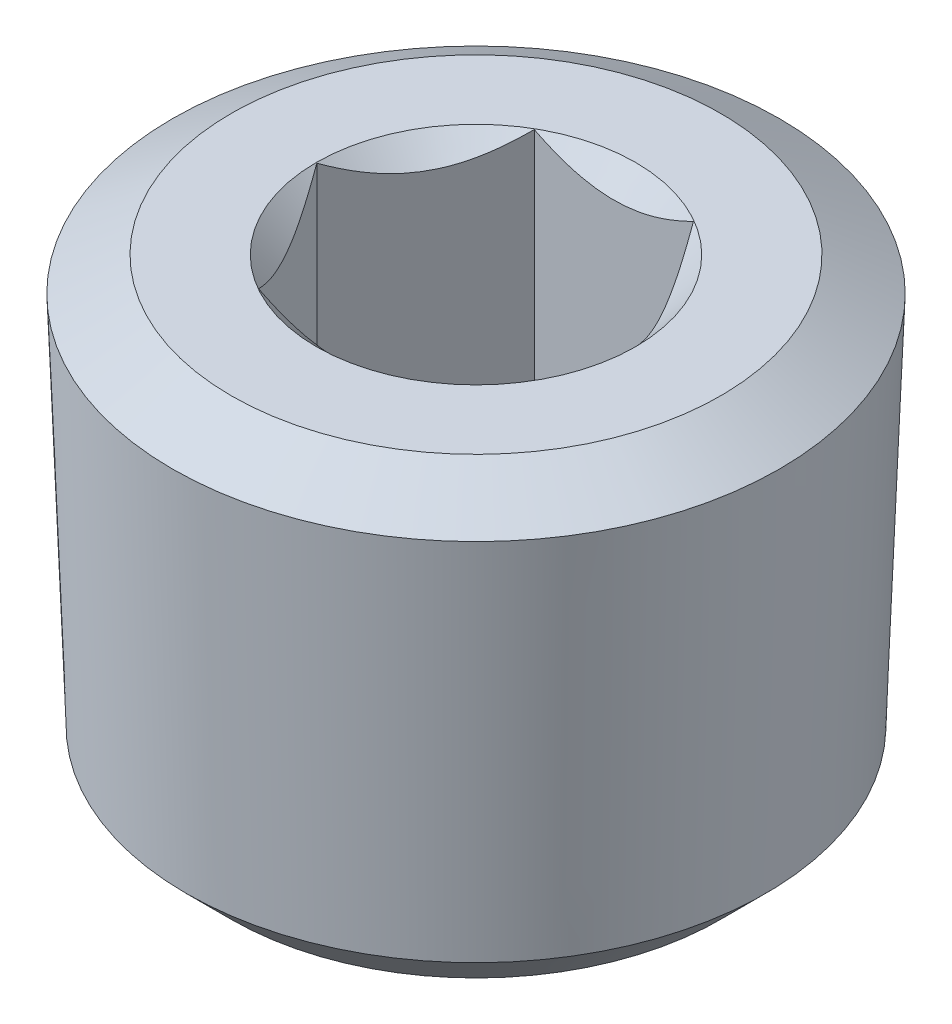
SolidWorks part; units mm, degrees
ref_plane "Front Plane" through (0, 0, 0) normal (0, 0, 1) x (1, 0, 0)
ref_plane "Top Plane" through (0, 0, 0) normal (0, 1, 0) x (1, 0, 0)
ref_plane "Right Plane" through (0, 0, 0) normal (1, 0, 0) x (0, 0, -1)
sketch "Sketch2" plane through (0, 0, 0) normal (0, 0, 1) x (1, 0, 0)
  line L0 (0, 10.7443) -> (0, -17.0657) construction
  line L1 (0, 0) -> (-8.5652, 0)
  line L2 (-10.6247, -1.189) -> (-10.1469, -14.2933)
  line L3 (-8.5652, -15.875) -> (0, -15.875)
  line L4 (0, -15.875) -> (0, 0)
  line L6 (-8.5652, -15.875) -> (-10.1469, -14.2933)
  line L7 (-8.5652, 0) -> (-10.6247, -1.189)
  point P4 (-10.668, 0)
  point P6 (-10.0892, -15.875)
  dimension "D1" = 15.875
  dimension "D2" = 2.088
  dimension "D3" = 21.336
  dimension "D4" = 30
  dimension "D5" = 1.524
  dimension "D6" = 45
revolve "Revolve1" add sketch "Sketch2" angle 360 about L0
sketch "Sketch3" plane through (0, 0, 0) normal (0, 0, 1) x (1, 0, 0)
  line L0 (0, 2.9342) -> (0, -8.1202) construction
  line L1 (0, 0) -> (-5.588, 0)
  line L2 (8.5652, 0) -> (-8.5652, 0) construction
  line L3 (-4.826, -0.762) -> (-4.826, -9.652)
  line L4 (-4.826, -9.652) -> (-0.5987, -12.192)
  line L5 (0, -12.192) -> (0, 0)
  line L6 (-4.826, -0.762) -> (-5.588, 0)
  line L7 (-0.5987, -12.192) -> (0, -12.192)
  dimension "D1" = 9.652
  dimension "D2" = 59
  dimension "D3" = 9.652
  dimension "D4" = 0.762
  dimension "D5" = 45
  dimension "D6" = 12.192
revolve "Cut-Revolve1" cut sketch "Sketch3" angle 360 about L0
sketch "Sketch4" plane through (0, 0, 0) normal (0, 1, 0) x (1, 0, 0)
  line L1 (-2.7863, -4.826) -> (2.7863, -4.826)
  line L2 (2.7863, -4.826) -> (5.5726, 0)
  line L3 (5.5726, 0) -> (2.7863, 4.826)
  line L4 (2.7863, 4.826) -> (-2.7863, 4.826)
  line L5 (-2.7863, 4.826) -> (-5.5726, 0)
  line L6 (-5.5726, 0) -> (-2.7863, -4.826)
  circle A0 centre (0, 0) radius 4.826 construction
  circle A1 centre (0, 0) radius 4.826 construction
extrude "Cut-Extrude1" cut sketch "Sketch4" against normal up to vertex (5.2929 mm away)
